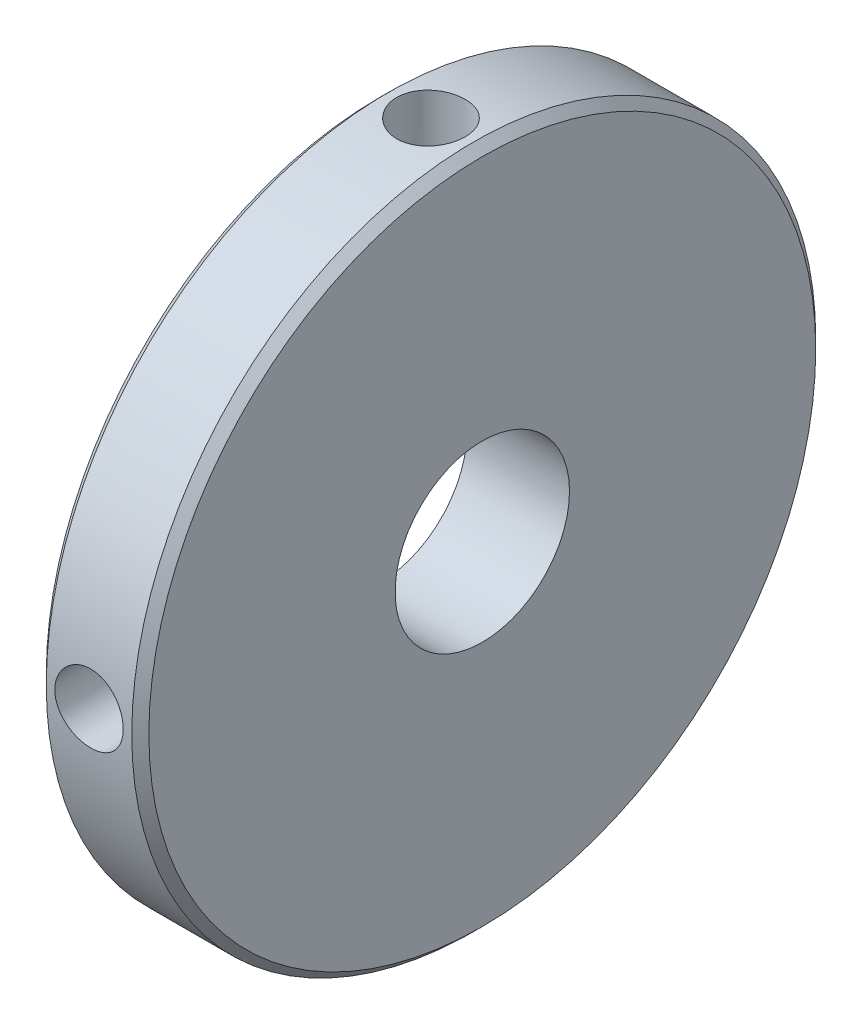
SolidWorks part; units mm, degrees
ref_plane "Face" through (0, 0, 0) normal (0, 0, 1) x (1, 0, 0)
ref_plane "Dessus" through (0, 0, 0) normal (0, 1, 0) x (1, 0, 0)
ref_plane "Droite" through (0, 0, 0) normal (1, 0, 0) x (0, 0, -1)
sketch "Esquisse1" plane through (0, 0, 0) normal (0, 0, 1) x (1, 0, 0)
  line L0 (-6.2215, 0) -> (35.632, 0) construction
  line L1 (0, 0) -> (6, 0)
  line L2 (0, 0) -> (0, 20)
  line L3 (0, 20) -> (6, 20)
  line L4 (6, 0) -> (6, 20)
  dimension "D1" = 20
  dimension "D2" = 6
revolve "Base-Révolution" add sketch "Esquisse1" angle 360 about L0
chamfer "Chanfrein1" distance 0.5 angle 45 2 edges at (6, 0, 20) (0, 0, 20)
sketch "Esquisse2" plane through (0, 0, 0) normal (0, 0, 1) x (1, 0, 0)
  line L0 (5.5, 20) -> (0.5, 20) construction
  line L1 (5, 20) -> (3, 20)
  line L2 (5, 20) -> (5, 15)
  line L3 (5, 15) -> (3, 13.7983)
  line L4 (3, 13.7983) -> (3, 20)
  line L5 (3, 20) -> (3, 12.9338) construction
  dimension "D1" = 2
  dimension "D2" = 59
  dimension "D3" = 5
  dimension "D4" = 3
revolve "Trou radial" cut sketch "Esquisse2" angle 360 about L5
ref_axis "Axe de révolution" through (43.7785, 0, 0) along (-1, 0, 0)
pattern_circular "Répétition circulaire1" count 4 over 360 about axis through (43.7785, 0, 0) along (-1, 0, 0) of "Trou radial"
hole_wizard "Trou taraudé M12x1.752" positions "Esquisse6" profile "Esquisse5" tap size "M12x1.75" standard "ISO"
sketch "Esquisse6" plane through (6, 0, 0) normal (1, 0, 0) x (0, 0, -1)
  circle A0 centre (0, 0) radius 19.5 construction
  point P0 (0, 0)
sketch "Esquisse5" plane through (6, 0, 0) normal (0, 1, 0) x (0, 0, -1)
  line L0 (0, 0) -> (0, 6)
  line L1 (0, 6) -> (5.1, 6)
  line L2 (5.1, 6) -> (5.1, 0)
  line L5 (5.1, 0) -> (0, 0)
  line L11 (0, -6.35) -> (0, 107.95) construction
  dimension "Diamètre du perçage jusqu'au prochain" = 10.2
  dimension "Profondeur du perçage jusqu'au prochain" = 6
sketch "Esq_WRNL_Compact001" plane through (0, 0, 0) normal (0, 0, 1) x (1, 0, 0)
  line L0 (-1, -21) -> (-1, 21)
  line L1 (7, -21) -> (7, 21)
  line L2 (-1, -21) -> (7, -21)
  line L3 (-1, 21) -> (7, 21)
equation "\"D4@Esquisse2\" = \"D2@Esquisse1\"/2"
